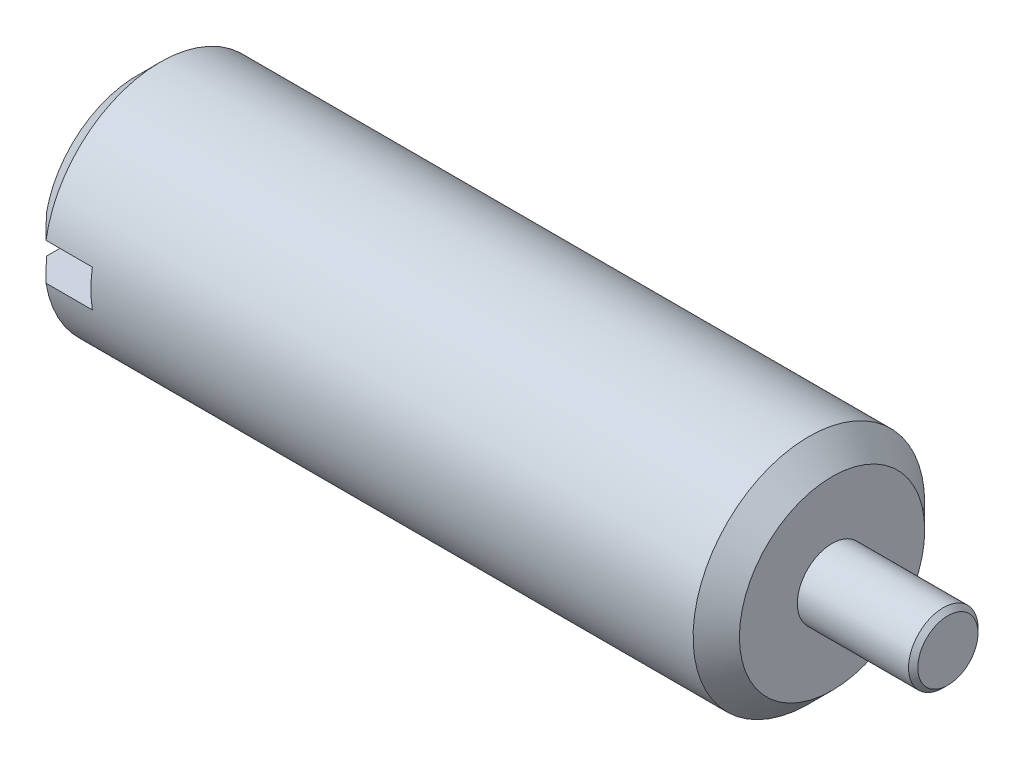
SolidWorks part; units mm, degrees
ref_plane "前视" through (0, 0, 0) normal (0, 0, 1) x (1, 0, 0)
ref_plane "上视" through (0, 0, 0) normal (0, 1, 0) x (1, 0, 0)
ref_plane "右视" through (0, 0, 0) normal (1, 0, 0) x (0, 0, -1)
sketch "草图1" plane through (0, 0, 0) normal (1, 0, 0) x (0, 0, -1)
  circle A0 centre (0, 0) radius 5
  dimension "D1" = 10
extrude "拉伸1" add sketch "草图1" along normal blind 30
sketch "草图2" plane through (0, 0, 0) normal (0, 0, 1) x (1, 0, 0)
  line L0 (0, 0) -> (7.0333, 0) construction
  line L1 (30, 0) -> (0, 0) construction
  line L2 (0, 5) -> (0, -5) construction
  line L3 (0, 0.8) -> (0, -0.8)
  line L4 (3, 0.8) -> (0, 0.8)
  line L5 (3, -0.8) -> (0, -0.8)
  line L6 (3, 0.8) -> (3, -0.8)
  point P14 (3, 0)
  dimension "D1" = 1.6
  dimension "D2" = 3
extrude "切除-拉伸1" cut sketch "草图2" against normal through all and the other way through all
chamfer "倒角1" distance 1 angle 45
chamfer "倒角2" distance 1 angle 45
sketch "草图3" plane through (30, 0, 0) normal (1, 0, 0) x (0, 0, -1)
  circle A0 centre (0, 0) radius 1.5
  dimension "D1" = 3
extrude "拉伸2" add sketch "草图3" along normal blind 5
chamfer "倒角3" distance 0.2 angle 45
